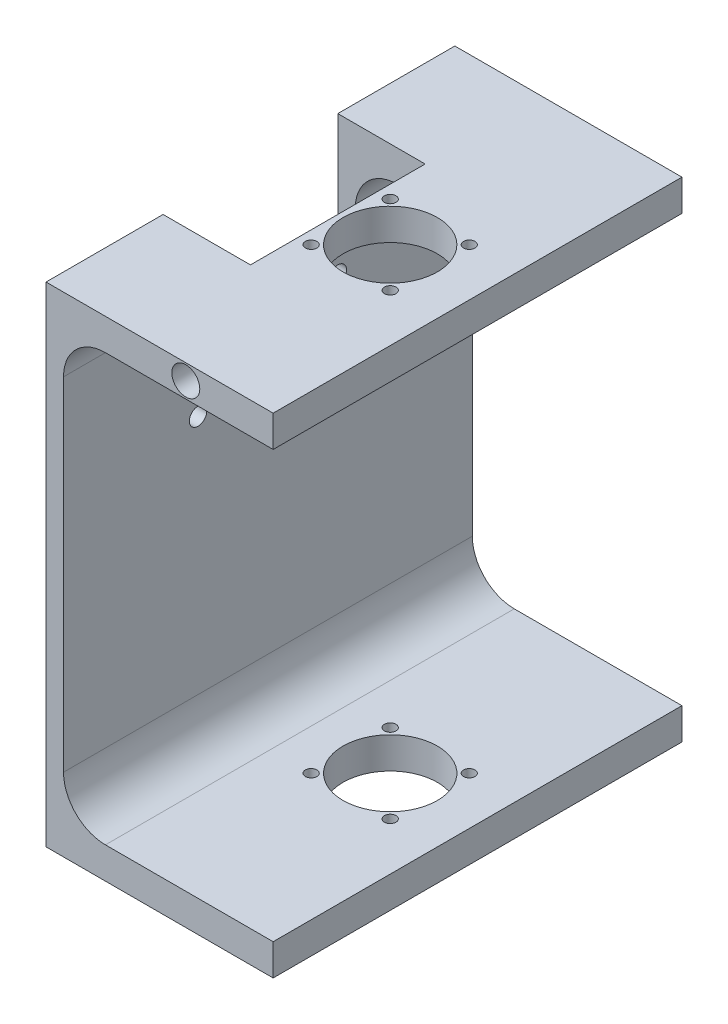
SolidWorks part; units mm, degrees
ref_plane "Face" through (0, 0, 0) normal (0, 0, 1) x (1, 0, 0)
ref_plane "Dessus" through (0, 0, 0) normal (0, 1, 0) x (1, 0, 0)
ref_plane "Droite" through (0, 0, 0) normal (1, 0, 0) x (0, 0, -1)
sketch "Esquisse1" plane through (0, 0, 0) normal (0, 0, 1) x (1, 0, 0)
  line L0 (65, -61) -> (65, -70)
  line L1 (65, 70) -> (0, 70)
  line L2 (65, 70) -> (65, 61)
  line L3 (65, -70) -> (0, -70)
  line L4 (0, 70) -> (0, -70)
  line L5 (65, 61) -> (5, 61)
  line L7 (65, -61) -> (5, -61)
  line L8 (5, 61) -> (5, -61)
  dimension "D1" = 140
  dimension "D2" = 65
  dimension "D3" = 5
  dimension "D4" = 9
extrude "Extrusion1" add sketch "Esquisse1" along normal mid plane 117
fillet "Congé1" radius 12 2 edges at (5, 61, 0) (5, -61, 0)
sketch "Esquisse2" plane through (0, 70, 0) normal (0, 1, 0) x (-1, 0, 0)
  line L0 (-40, 0) -> (-65, 0) construction
  line L1 (-65, 58.5) -> (-65, -58.5) construction
  circle A0 centre (-40, 0) radius 13.5
  dimension "D1" = 27
  dimension "D2" = 25
extrude "Enlèv. mat.-Extru.1" cut sketch "Esquisse2" against normal through all
sketch "Esquisse4" plane through (0, 70, 0) normal (0, 1, 0) x (-1, 0, 0)
  line L0 (96.6454, 0) -> (0, 0) construction
  line L1 (-25, -25) -> (96.6454, -25)
  line L2 (-25, -25) -> (-25, 25)
  line L3 (-25, 25) -> (96.6454, 25)
  line L4 (96.6454, -25) -> (96.6454, 25)
  line L5 (0, 58.5) -> (0, -58.5) construction
  dimension "D1" = 25
  dimension "D2" = 50
extrude "Enlèv. mat.-Extru.3" cut sketch "Esquisse4" against normal blind 30
hole_wizard "Trou taraudé M4x0.71" positions "Esquisse6" profile "Esquisse5" tap size "M4x0.7" standard "ISO"
sketch "Esquisse6" plane through (0, -70, 0) normal (0, -1, 0) x (1, 0, 0)
  line L1 (28.6863, 11.3137) -> (51.3137, 11.3137) construction
  line L2 (28.6863, 11.3137) -> (28.6863, -11.3137) construction
  line L3 (28.6863, -11.3137) -> (51.3137, -11.3137) construction
  line L4 (51.3137, 11.3137) -> (51.3137, -11.3137) construction
  circle A0 centre (40, 0) radius 16 construction
  circle A1 centre (40, 0) radius 13.5 construction
  point P0 (51.3137, 11.3137)
  point P5 (51.3137, -11.3137)
  point P6 (28.6863, -11.3137)
  point P7 (28.6863, 11.3137)
  dimension "D1" = 32
sketch "Esquisse5" plane through (51.3137, -70, 11.3137) normal (1, 0, 0) x (0, 0, -1)
  line L0 (0, 0) -> (0, 140)
  line L1 (0, 140) -> (1.65, 140)
  line L2 (1.65, 140) -> (1.65, 0)
  line L5 (1.65, 0) -> (0, 0)
  line L11 (0, -6.35) -> (0, 107.95) construction
  dimension "Diamètre du trou pour taraudage jusqu'au prochain" = 3.3
  dimension "Profondeur du trou pour taraudage jusqu'au prochain" = 140
hole_wizard "Diamètre du perçage M8.0 (8)1" positions "Esquisse10" profile "Esquisse9" hole size "M8.0" standard "Ansi Métrique"
sketch "Esquisse10" plane through (0, 0, -58.5) normal (0, 0, -1) x (-1, 0, 0)
  line L0 (-65, 65.5) -> (-40, 65.5) construction
  line L1 (-65, 61) -> (-65, 70) construction
  point P0 (-40, 65.5)
  dimension "D1" = 25
sketch "Esquisse9" plane through (40, 65.5, -58.5) normal (1, 0, 0) x (0, 1, 0)
  line L0 (0, 0) -> (0, 20.4034)
  line L1 (0, 20.4034) -> (4, 18)
  line L2 (4, 18) -> (4, 0)
  line L5 (4, 0) -> (0, 0)
  line L10 (0, 20.4034) -> (-4, 18) construction
  line L11 (0, -6.35) -> (0, 107.95) construction
  dimension "Diamètre du perçage" = 8
  dimension "Profondeur du perçage" = 18
  dimension "Angle de pointe" = 118
mirror "Symétrie1" about plane through (0, 0, 0) normal (0, 0, 1) of "Diamètre du perçage M8.0 (8)1"
hole_wizard "Trou taraudé M6x1.01" positions "Esquisse12" profile "Esquisse11" tap size "M6x1.0" standard "ISO"
sketch "Esquisse12" plane through (0, 0, 0) normal (-1, 0, 0) x (0, 0, 1)
  line L0 (0, 35) -> (0, 0) construction
  line L1 (-20, 35) -> (20, 35) construction
  line L2 (-20, 35) -> (-20, 20) construction
  line L3 (-20, 20) -> (20, 20) construction
  line L4 (20, 35) -> (20, 20) construction
  point P0 (-20, 20)
  point P1 (-20, 35)
  point P2 (20, 35)
  point P3 (20, 20)
  dimension "D1" = 15
  dimension "D2" = 40
  dimension "D3" = 35
sketch "Esquisse11" plane through (0, 20, -20) normal (0, 1, 0) x (0, 0, 1)
  line L0 (0, 0) -> (0, 16.5022)
  line L1 (0, 16.5022) -> (2.5, 15)
  line L2 (2.5, 15) -> (2.5, 0)
  line L5 (2.5, 0) -> (0, 0)
  line L10 (0, 16.5022) -> (-2.5, 15) construction
  line L11 (0, -6.35) -> (0, 107.95) construction
  dimension "Diamètre du trou pour taraudage" = 5
  dimension "Profondeur du trou pour taraudage" = 15
  dimension "Angle de pointe" = 118
